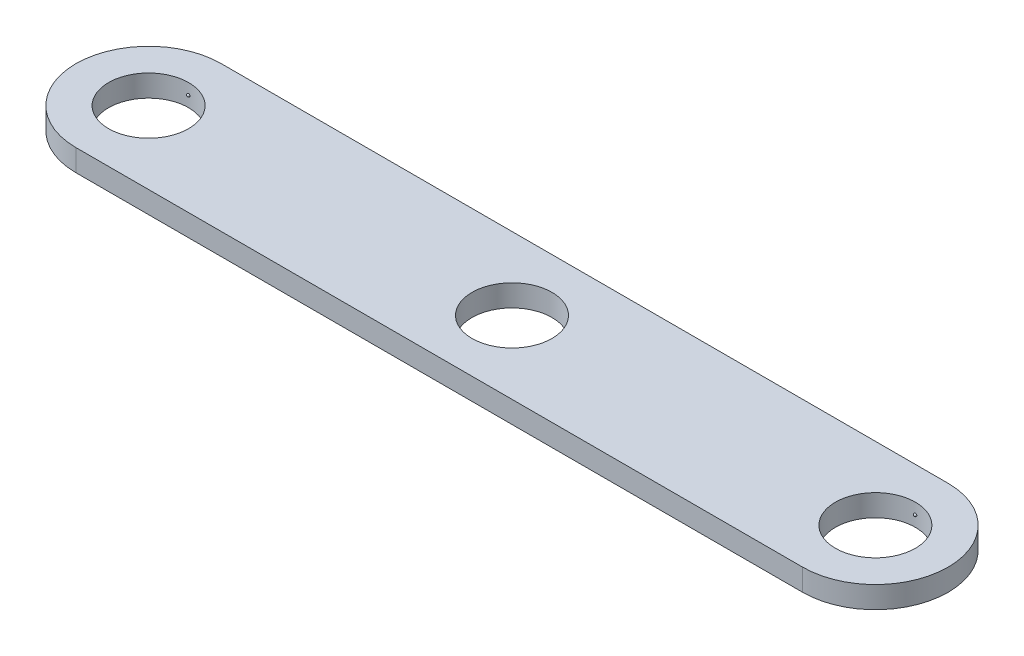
SolidWorks part; units mm, degrees
ref_plane "Front" through (0, 0, 0) normal (0, 0, 1) x (1, 0, 0)
ref_plane "Top" through (0, 0, 0) normal (0, 1, 0) x (1, 0, 0)
ref_plane "Right" through (0, 0, 0) normal (1, 0, 0) x (0, 0, -1)
sketch "Sketch1" plane through (0, 0, 0) normal (0, 1, 0) x (1, 0, 0)
  line L1 (0, -5) -> (50, -5)
  line L2 (0, 5) -> (50, 5)
  circle A0 centre (25, 0) radius 2.75
  circle A1 centre (50, 0) radius 2.75
  circle A2 centre (0, 0) radius 2.75
  arc A3 (50, -5) -> (50, 5) centre (50, 0) ccw
  arc A4 (0, 5) -> (0, -5) centre (0, 0) ccw
  dimension "D1" = 50
extrude "Extrude1" add sketch "Sketch1" along normal blind 1.5
ref_plane "Plane1" through (0, 0.75, 0) normal (0, 1, 0) x (-1, 0, 0)
sketch "Sketch4" plane through (0, 0.75, 0) normal (0, 1, 0) x (-1, 0, 0)
  line L0 (-50.1, -2.75) -> (-49.9, -2.75)
  line L1 (-0.1, -2.75) -> (0.1, -2.75)
  arc A0 (0.1, -2.75) -> (-0.1, -2.75) centre (0, -2.75) ccw
  circle A1 centre (0, 0) radius 2.75 construction
  arc A2 (-49.9, -2.75) -> (-50.1, -2.75) centre (-50, -2.75) ccw
  circle A3 centre (-50, 0) radius 2.75 construction
revolve "Revolve3" add sketch "Sketch4" angle 360 about L1
